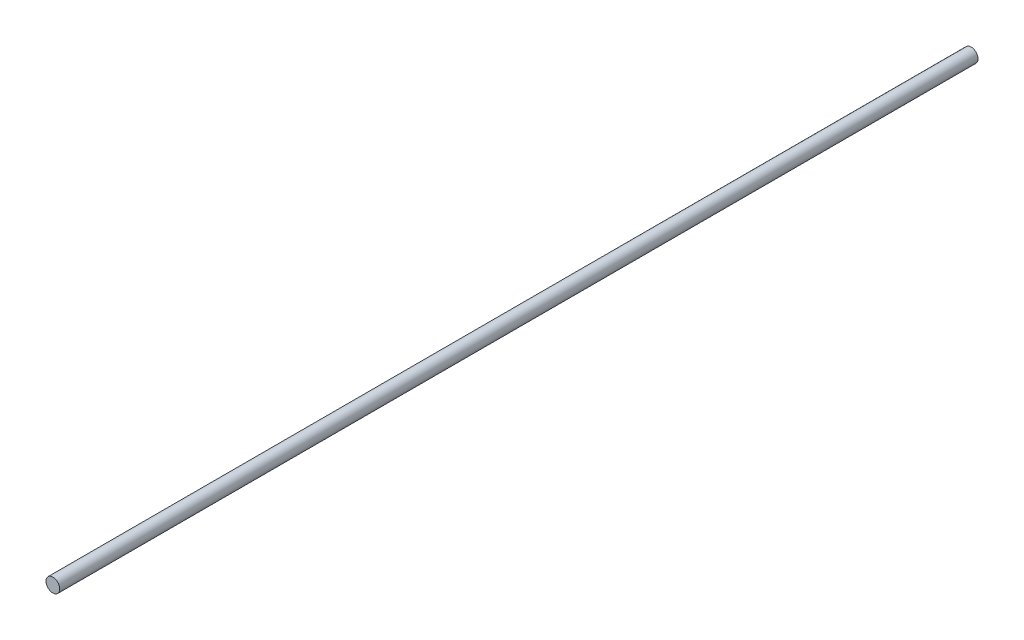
SolidWorks part; units mm, degrees
ref_plane "Front Plane" through (0, 0, 0) normal (0, 0, 1) x (1, 0, 0)
ref_plane "Top Plane" through (0, 0, 0) normal (0, 1, 0) x (1, 0, 0)
ref_plane "Right Plane" through (0, 0, 0) normal (1, 0, 0) x (0, 0, -1)
sketch "Sketch1" plane through (0, 0, 0) normal (0, 0, 1) x (1, 0, 0)
  circle A0 centre (0, 0) radius 30
  dimension "D1" = 60
extrude "Boss-Extrude1" add sketch "Sketch1" against normal blind 4000
